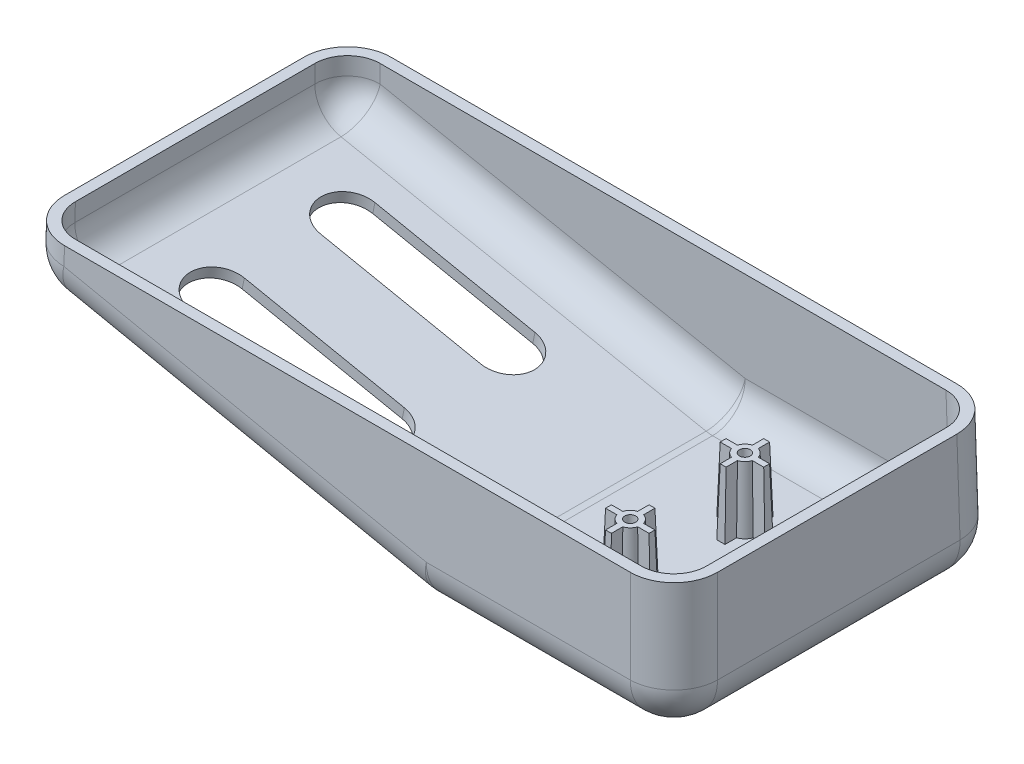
SolidWorks part; units mm, degrees
ref_plane "Front Plane" through (0, 0, 0) normal (0, 0, 1) x (1, 0, 0)
ref_plane "Top Plane" through (0, 0, 0) normal (0, 1, 0) x (1, 0, 0)
ref_plane "Right Plane" through (0, 0, 0) normal (1, 0, 0) x (0, 0, -1)
sketch "Sketch1" plane through (0, 0, 0) normal (0, 0, 1) x (1, 0, 0)
  line L0 (0, 0) -> (120, 0)
  line L1 (120, 0) -> (120, -25)
  line L2 (120, -25) -> (74, -25)
  line L3 (74, -25) -> (0, -10)
  line L4 (0, -10) -> (0, 0)
  dimension "D1" = 120
  dimension "D2" = 25
  dimension "D3" = 10
  dimension "D4" = 46
extrude "Extrude1" add sketch "Sketch1" along normal mid plane 60
draft "Draft1" type of draft neutral plane draft angle 1 faces to draft 4 parameters "D1"=1
fillet "Fillet2" radius 8 11 edges at (-0.087, -4.9824, -30.087) (36.913, -17.4824, -30.3052) (97.2182, -25, -30.4364) (120.2182, -12.5, -30.2182) (36.913, -17.4824, 30.3052) (97.2182, -25, 30.4364) (120.2182, -12.5, 30.2182) (120.4364, -25, 0) (74, -25, 0) (-0.1739, -9.9647, 0) (-0.087, -4.9824, 30.087)
shell "Shell2" thickness 2
sketch "Sketch2" plane through (-1.5497, -7.6452, 0) normal (0.1987, 0.9801, 0) x (0.9801, -0.1987, 0)
  line L0 (13.4252, 0) -> (69.2046, 0) construction
  line L1 (20, 17) -> (50, 17)
  line L2 (20, -17) -> (50, -17)
  line L3 (50, 7) -> (20, 7)
  line L4 (50, -7) -> (20, -7)
  line L6 (0, -22.0012) -> (0, 22.0012) construction
  line L8 (109.7688, 30) -> (7.8393, 30) construction
  arc A0 (50, 17) -> (50, 7) centre (50, 12) cw
  arc A1 (50, -17) -> (50, -7) centre (50, -12) ccw
  arc A2 (20, 7) -> (20, 17) centre (20, 12) cw
  arc A3 (20, -7) -> (20, -17) centre (20, -12) ccw
  point P19 (-14.8546, 13.0672)
  dimension "D1" = 5
  dimension "D2" = 24
  dimension "D3" = 30
  dimension "D4" = 20
  dimension "D5" = 18
extrude "Extrude2" cut sketch "Sketch2" against normal up to next
sketch3d "3DSketch1"
  line L1 (74, -25, -30.4364) -> (120.4364, -25, -30.4364) construction
  line L2 (120.4364, -25, 30.4364) -> (120.4364, -25, -30.4364) construction
  point P0 (92.5079, -23, -10.5366)
  dimension "D1" = 20
  dimension "D2" = 28
other "Mounting Boss1" parameters "BossDiam"=4.8, "BossHeight"=12, "FinHeight"=12, "FinLength"=4, "FinWidth"=1.5, "InsDiam"=2, "InsHeight"=5, "BossDraft"=2, "FinDraft"=1, "InsDraft"=1
mirror "Mirror1" about plane through (0, 0, 0) normal (0, 0, 1) of "Mounting Boss1"
